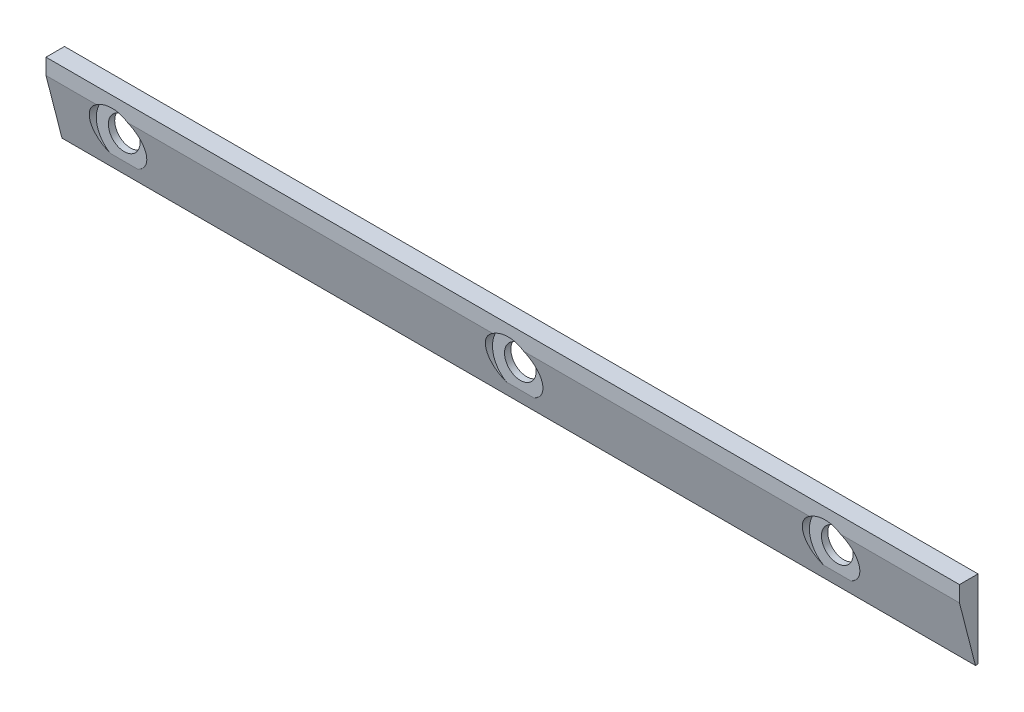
SolidWorks part; units mm, degrees
ref_plane "Front Plane" through (0, 0, 0) normal (0, 0, 1) x (1, 0, 0)
ref_plane "Top Plane" through (0, 0, 0) normal (0, 1, 0) x (1, 0, 0)
ref_plane "Right Plane" through (0, 0, 0) normal (1, 0, 0) x (0, 0, -1)
sketch "Sketch1" plane through (0, 0, 0) normal (1, 0, 0) x (0, 0, -1)
  line L0 (0, 0) -> (0, -7.8232)
  line L1 (0, 0) -> (-1.8542, 0)
  line L2 (-1.8542, 0) -> (-1.8542, -1.5875)
  line L3 (0, -7.8232) -> (-0.254, -7.8232)
  line L4 (-0.254, -7.8232) -> (-1.8542, -1.5875)
  dimension "D1" = 1.8542
  dimension "D2" = 7.8232
  dimension "D3" = 1.5875
  dimension "D4" = 0.254
extrude "Boss-Extrude1" add sketch "Sketch1" along normal mid plane 91.5162
sketch "Sketch2" plane through (0, 0, 0) normal (0, 0, -1) x (-1, 0, 0)
  line L0 (-45.7581, -3.9116) -> (58.5846, -3.9116) construction
  line L1 (-45.7581, -7.8232) -> (-45.7581, 0) construction
  circle A0 centre (-32.2961, -3.9116) radius 1.5875
  circle A1 centre (-0.5461, -3.9116) radius 1.5875
  circle A2 centre (39.1414, -3.9116) radius 1.5875
  dimension "D1" = 13.462
  dimension "D2" = 3.175
  dimension "D3" = 31.75
  dimension "D4" = 39.6875
extrude "Cut-Extrude1" cut sketch "Sketch2" against normal through all
sketch "Sketch3" plane through (0, 0, 0) normal (0, 0, -1) x (-1, 0, 0)
  circle A0 centre (-32.2961, -3.9116) radius 2.794
  circle A1 centre (-0.5461, -3.9116) radius 2.794
  circle A2 centre (39.1414, -3.9116) radius 2.794
  dimension "D1" = 5.588
extrude "Cut-Extrude2" cut sketch "Sketch3" against normal through all from offset 0.635
